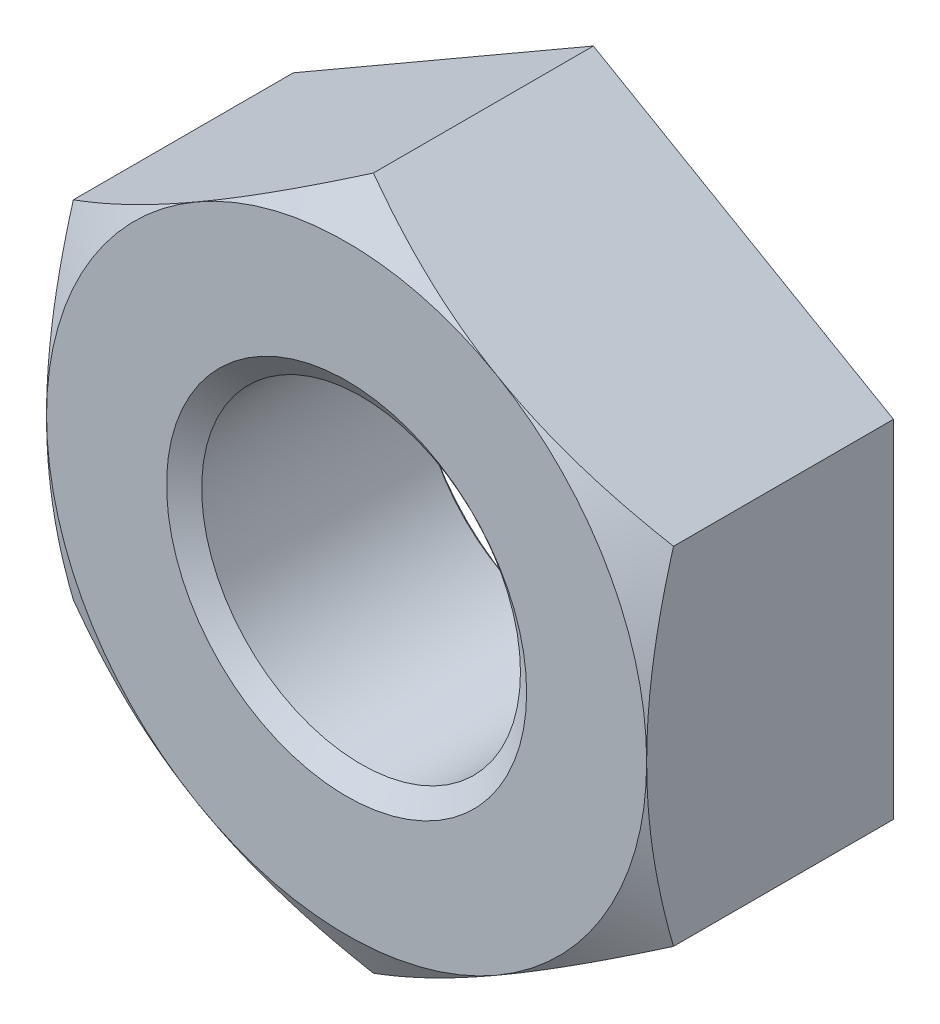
SolidWorks part; units mm, degrees
ref_plane "Plane1" through (0, 0, 0) normal (0, 0, 1) x (1, 0, 0)
ref_plane "Plane2" through (0, 0, 0) normal (0, 1, 0) x (1, 0, 0)
ref_plane "Plane3" through (0, 0, 0) normal (1, 0, 0) x (0, 0, -1)
revolve "EndChamfer" cut sketch "EndChamferSketch" angle 360 about L11
sketch "EndChamferSketch" plane through (0, 0, 0) normal (1, 0, 0) x (0, 0, -1)
  line L0 (6.5024, 4.7625) -> (6.0818, 4.1618)
  line L1 (6.5532, 4.7625) -> (6.5024, 4.7625)
  line L2 (6.5532, 4.7625) -> (6.5532, 4.1618)
  line L3 (6.5532, 4.1618) -> (6.0818, 4.1618)
  line L6 (-0.0508, 4.7625) -> (0, 4.7625)
  line L7 (0, 4.7625) -> (0.4206, 4.1618)
  line L9 (0.4206, 4.1618) -> (-0.0508, 4.1618)
  line L10 (-0.0508, 4.1618) -> (-0.0508, 4.7625)
  line L11 (25.0375, 0) -> (38.388, 0) construction
  dimension "D1" = 35
  dimension "D2" = 0.0508
  dimension "Offset1" = 6.5532
  dimension "ThreadMajor" = 4.7625
  dimension "ChamferDepth" = 0.6007
  dimension "Offset2" = 6.604
extrude "BaseNut" add sketch "BaseNutSke" against normal blind 6.5278
sketch "BaseNutSke" plane through (0, 0, 0) normal (0, 0, 1) x (1, 0, 0)
  line L6 (7.9375, 4.5827) -> (7.9375, -4.5827)
  line L7 (-7.9375, 4.5827) -> (-7.9375, -4.5827)
  line L8 (7.9375, 4.5827) -> (0, 9.1654)
  line L9 (0, 9.1654) -> (-7.9375, 4.5827)
  line L10 (-7.9375, -4.5827) -> (0, -9.1654)
  line L11 (0, -9.1654) -> (7.9375, -4.5827)
  circle A0 centre (0, 0) radius 4.2164
  dimension "D4" = 7.9375
  dimension "Thread_min" = 8.4328
  dimension "D1" = 120
  dimension "D2" = 7.9375
  dimension "D3" = 7.9375
  dimension "Width_flats" = 15.875
sketch "Sketch4" plane through (0, 0, 0) normal (1, 0, 0) x (0, 0, -1)
  line L4 (0, 0) -> (34.925, 0) construction
  line L7 (0, 7.9375) -> (-12.7, 7.9375)
  line L8 (0, 4.5827) -> (0, 9.1654) construction
  line L9 (0.7089, 9.1654) -> (0.7089, 21.8654)
  line L10 (0.7089, 21.8654) -> (-12.7, 21.8654)
  line L11 (-12.7, 21.8654) -> (-12.7, 7.9375)
  line L12 (0, 7.9375) -> (0.7089, 9.1654)
  line L14 (0, 4.5827) -> (0, -4.5827) construction
  line L15 (6.5278, 9.1654) -> (0, 9.1654) construction
  dimension "D1" = 7.9375
  dimension "D2" = 30
  dimension "D3" = 12.7
  dimension "D4" = 12.7
revolve "Single-Chamfer" cut sketch "Sketch4" angle 360 about L4
sketch "Sketch3" plane through (0, 0, 0) normal (1, 0, 0) x (0, 0, -1)
  line L0 (6.5278, 7.9375) -> (5.8189, 9.1654)
  line L1 (5.8189, 9.1654) -> (5.8189, 21.8654)
  line L2 (5.8189, 21.8654) -> (19.2278, 21.8654)
  line L3 (19.2278, 21.8654) -> (19.2278, 7.9375)
  line L4 (19.2278, 7.9375) -> (6.5278, 7.9375)
  line L5 (6.5278, 4.5827) -> (6.5278, 9.1654) construction
  line L6 (6.5278, 9.1654) -> (0.7089, 9.1654) construction
  line L7 (0, 0) -> (38.6776, 0) construction
  line L8 (6.5278, 0) -> (0, 0) construction
  line L9 (3.6184, 9.1654) -> (3.6184, 44.222) construction
  line L10 (1.4179, 21.8654) -> (-11.9911, 21.8654)
  line L11 (-11.9911, 21.8654) -> (-11.9911, 7.9375)
  line L12 (-11.9911, 7.9375) -> (0.7089, 7.9375)
  line L13 (0.7089, 7.9375) -> (1.4179, 9.1654)
  line L14 (1.4179, 9.1654) -> (1.4179, 21.8654)
  line L16 (6.5278, 9.1654) -> (0.7089, 9.1654) construction
  dimension "D1" = 7.9375
  dimension "D2" = 30
  dimension "D3" = 12.7
  dimension "D4" = 12.7
revolve "Double-Chamfer" [suppressed] cut sketch "Sketch3" angle 360 about L7
sketch "ThdSchSke" plane through (0, 0, 0) normal (0, 1, 0) x (1, 0, 0)
  line L0 (-4.7625, 0.0254) -> (-4.2164, 0.4078)
  line L1 (-4.2164, 0.4078) -> (-2.1082, 0.4078)
  line L2 (-2.1082, 0.4078) -> (-2.1082, -0.357)
  line L3 (-2.1082, -0.357) -> (-4.2164, -0.357)
  line L4 (-4.2164, -0.357) -> (-4.7625, 0.0254)
  line L6 (0, 3.9624) -> (0, -2.9874) construction
  line L7 (-3.175, 1.0846) -> (3.175, 1.0846) construction
  dimension "D1" = 0.0254
  dimension "VeeAngle" = 70
  dimension "SideAngle" = 55
  dimension "OverCut" = 4.2164
  dimension "Advance" = 1.0592
  dimension "Thread_major" = 9.525
  dimension "Tap_drill" = 8.4328
revolve "ThreadSchematic" [suppressed] cut sketch "ThdSchSke" angle 360 about L6
pattern_linear "ThdSchPat" [suppressed]
equation "\"D2@BaseNutSke\" = \"Width_flats@BaseNutSke\" / 2"
equation "\"D3@BaseNutSke\" = \"Width_flats@BaseNutSke\" / 2"
equation "\"D1@Sketch3\" = \"Width_flats@BaseNutSke\" /2"
equation "\"D4@BaseNutSke\" = \"D3@BaseNutSke\""
equation "\"D1@Sketch4\" = \"Width_flats@BaseNutSke\" / 2"
equation "\"Thread_major@ThdSchSke\" = \"Thread_nominal@ThreadCosmetic\""
equation "\"Tap_drill@ThdSchSke\" = \"Thread_min@BaseNutSke\""
equation "\"Overcut@ThdSchSke\" = \"Tap_drill@ThdSchSke\" * 0.5"
equation "\"Num_threads@ThdSchPat\" = int(  ( \"Thickness@BaseNut\" - 0.002 ) / \"Advance@ThdSchSke\" + 0.999 )  + 1"
equation "\"Advance@ThdSchPat\" = ( \"Thickness@BaseNut\" - 0.002 ) /  (\"Num_threads@ThdSchPat\" - 1) 'relax it"
equation "' \"Num_threads@ThdSchPat\" = \"Num_threads@ThdSchPat\" - sgn( \"Num_threads@ThdSchPat\" - 1) '---chamfered tips only---"
equation "\"ThreadMajor@EndChamferSketch\" = \"Thread_nominal@ThreadCosmetic\" * 0.5"
equation "\"ChamferDepth@EndChamferSketch\" = (\"Thread_nominal@ThreadCosmetic\" - \"Thread_min@BaseNutSke\") * 0.55"
equation "\"Offset1@EndChamferSketch\" = \"Thickness@BaseNut\" + 0.001"
equation "\"Offset2@EndChamferSketch\" = \"Offset1@EndChamferSketch\" + 0.002"
